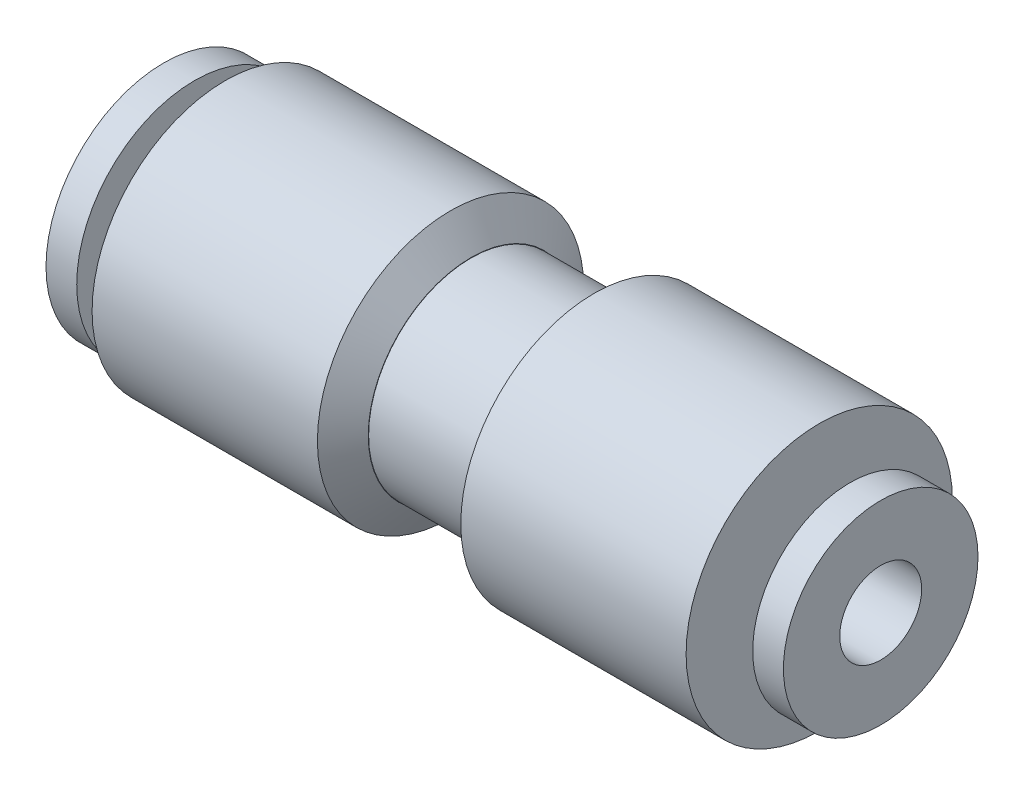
SolidWorks part; units mm, degrees
ref_plane "Front Plane" through (0, 0, 0) normal (0, 0, 1) x (1, 0, 0)
ref_plane "Top Plane" through (0, 0, 0) normal (0, 1, 0) x (1, 0, 0)
ref_plane "Right Plane" through (0, 0, 0) normal (1, 0, 0) x (0, 0, -1)
sketch "Sketch1" plane through (0, 0, 0) normal (1, 0, 0) x (0, 0, -1)
  circle A0 centre (0, 0) radius 6.5
extrude "Boss-Extrude1" add sketch "Sketch1" along normal blind 12
sketch "Sketch2" plane through (12, 0, 0) normal (1, 0, 0) x (0, 0, -1)
  circle A0 centre (0, 0) radius 5
extrude "Boss-Extrude2" add sketch "Sketch2" along normal blind 5
sketch "Sketch3" plane through (17, 0, 0) normal (1, 0, 0) x (0, 0, -1)
  circle A0 centre (0, 0) radius 6.5
extrude "Boss-Extrude3" add sketch "Sketch3" along normal blind 12
sketch "Sketch4" plane through (29, 0, 0) normal (1, 0, 0) x (0, 0, -1)
  circle A0 centre (0, 0) radius 2.5
extrude "Boss-Extrude4" add sketch "Sketch4" along normal blind 1.5
sketch "Sketch5" plane through (30.5, 0, 0) normal (1, 0, 0) x (0, 0, -1)
  circle A0 centre (0, 0) radius 4.75
extrude "Boss-Extrude5" add sketch "Sketch5" along normal blind 1.5
sketch "Sketch6" plane through (0, 0, 0) normal (-1, 0, 0) x (0, 0, 1)
  circle A0 centre (0, 0) radius 3.5
extrude "Boss-Extrude6" add sketch "Sketch6" along normal blind 1.5
sketch "Sketch7" plane through (-1.5, 0, 0) normal (-1, 0, 0) x (0, 0, 1)
  circle A0 centre (0, 0) radius 5.75
extrude "Boss-Extrude7" add sketch "Sketch7" along normal blind 1.5
sketch "Sketch8" plane through (-3, 0, 0) normal (-1, 0, 0) x (0, 0, 1)
  circle A0 centre (0, 0) radius 3
extrude "Cut-Extrude1" cut sketch "Sketch8" against normal blind 17.5
sketch "Sketch9" plane through (32, 0, 0) normal (1, 0, 0) x (0, 0, -1)
  circle A0 centre (0, 0) radius 2
extrude "Cut-Extrude2" cut sketch "Sketch9" against normal blind 17.5
chamfer "Chamfer3" distance 1 angle 56 2 edges at (17, 0, -6.5) (12, 0, -6.5)
